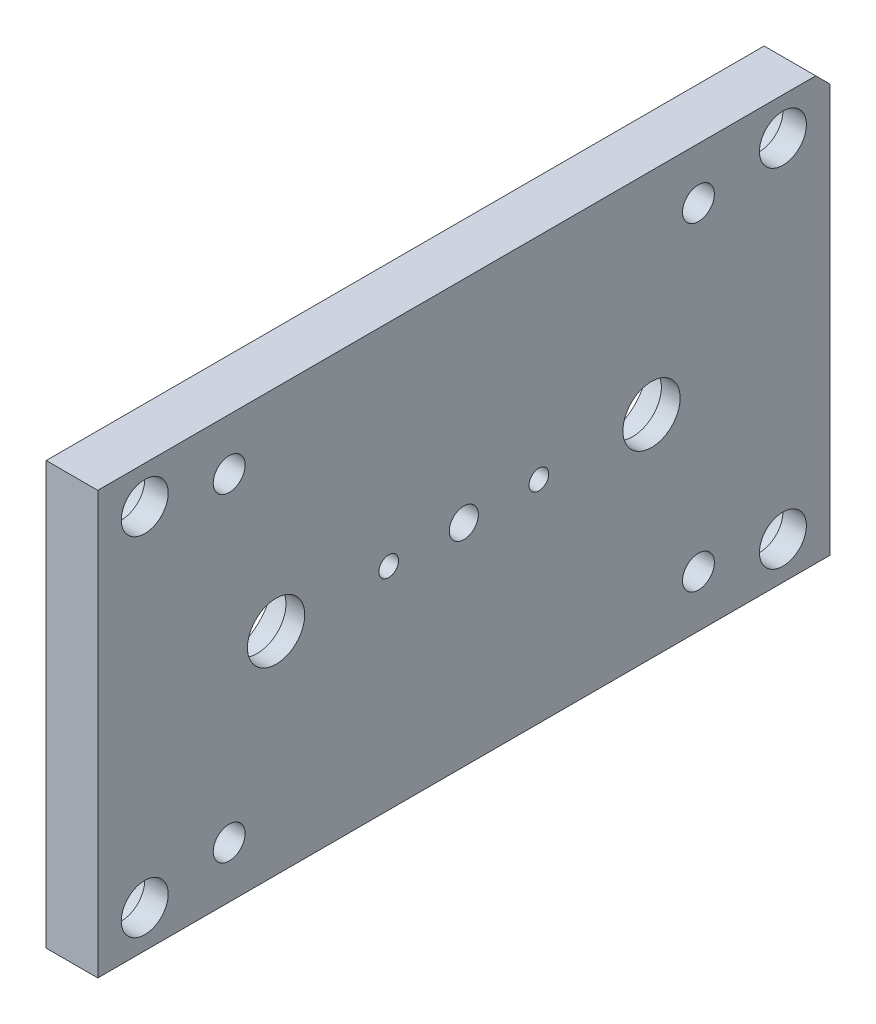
SolidWorks part; units mm, degrees
ref_plane "Plan de face" through (0, 0, 0) normal (0, 0, 1) x (1, 0, 0)
ref_plane "Plan de dessus" through (0, 0, 0) normal (0, 1, 0) x (1, 0, 0)
ref_plane "Plan de droite" through (0, 0, 0) normal (1, 0, 0) x (0, 0, -1)
sketch "Esquisse1" plane through (0, 0, 0) normal (1, 0, 0) x (0, 0, -1)
  line L1 (-78, 45) -> (78, 45)
  line L2 (-78, 45) -> (-78, -45)
  line L3 (-78, -45) -> (78, -45)
  line L4 (78, 45) -> (78, -45)
  point P4 (-78, 0)
  point P7 (0, -45)
  dimension "D1" = 156
  dimension "D2" = 90
extrude "Extrusion1" add sketch "Esquisse1" along normal blind 11
sketch "Esquisse32" plane through (0, 29.6948, -30.9346) normal (-1, 0, 0) x (0, 0, 1)
  line L1 (30.9346, 78) -> (30.9346, -78) construction
  line L6 (108.9346, -29.6948) -> (-47.0654, -29.6948) construction
  circle A0 centre (-9.0654, -29.6948) radius 6.1
  circle A1 centre (-37.0654, 7.3052) radius 5
  circle A4 centre (70.9346, -29.6948) radius 6.1
  circle A5 centre (98.9346, 7.3052) radius 5
  circle A6 centre (98.9346, -66.6948) radius 5
  circle A7 centre (-37.0654, -66.6948) radius 5
  circle A8 centre (30.9346, -29.6948) radius 3.1
  circle A9 centre (14.9346, -29.6948) radius 2.1
  circle A10 centre (46.9346, -29.6948) radius 2.1
  dimension "D3" = 10
  dimension "D4" = 68
  dimension "D5" = 6.2
  dimension "D6" = 12.2
  dimension "D7" = 16
  dimension "D11" = 40
  dimension "D12" = 37
  dimension "D17" = 4.2
  dimension "D13" = 136
  dimension "D25" = 40
  dimension "D16" = 16
  dimension "D14" = 74
extrude "Enlèv. mat.-Extru.1" cut sketch "Esquisse32" against normal through all
hole_wizard "Trou taraudé M81" positions "Esquisse34" profile "Esquisse33" tap size "M8" standard "ISO"
sketch "Esquisse34" plane through (0, 0, 0) normal (-1, 0, 0) x (0, 0, 1)
  point P0 (50, 34)
  point P1 (-50, 34)
  point P3 (-50, -34)
  point P5 (50, -34)
  dimension "D1" = 50
  dimension "D2" = 34
  dimension "D3" = 100
  dimension "D4" = 68
sketch "Esquisse33" plane through (0, 34, 50) normal (0, 1, 0) x (0, 0, 1)
  line L0 (0, 0) -> (0, 11)
  line L1 (0, 11) -> (3.4, 11)
  line L2 (3.4, 11) -> (3.4, 0)
  line L5 (3.4, 0) -> (0, 0)
  line L11 (0, -6.35) -> (0, 107.95) construction
  dimension "Diamètre du trou pour taraudage jusqu'au prochain" = 6.8
  dimension "Profondeur du trou pour taraudage jusqu'au prochain" = 11
sketch "Esquisse35" plane through (0, 0, 0) normal (-1, 0, 0) x (0, 0, 1)
  circle A0 centre (-68, 37) radius 7.5
  circle A1 centre (68, 37) radius 7.5
  circle A2 centre (68, -37) radius 7.5
  circle A3 centre (-68, -37) radius 7.5
  dimension "D1" = 15
extrude "Enlèv. mat.-Extru.2" cut sketch "Esquisse35" against normal blind 6
sketch "Esquisse37" plane through (0, 0, 0) normal (-1, 0, 0) x (0, 0, 1)
  circle A0 centre (-16, 0) radius 4.25
  circle A1 centre (16, 0) radius 4.25
  dimension "D1" = 8.5
extrude "Enlèv. mat.-Extru.4" cut sketch "Esquisse37" against normal blind 4
sketch "Esquisse38" plane through (0, 0, 0) normal (-1, 0, 0) x (0, 0, 1)
  circle A0 centre (-40, 0) radius 10.5
  circle A1 centre (40, 0) radius 10.5
  dimension "D1" = 21
  dimension "D2" = 21
extrude "Enlèv. mat.-Extru.5" cut sketch "Esquisse38" against normal blind 7
chamfer "Chanfrein_D" distance 3 angle 45 1 edges at (5.5, 45, -78)
